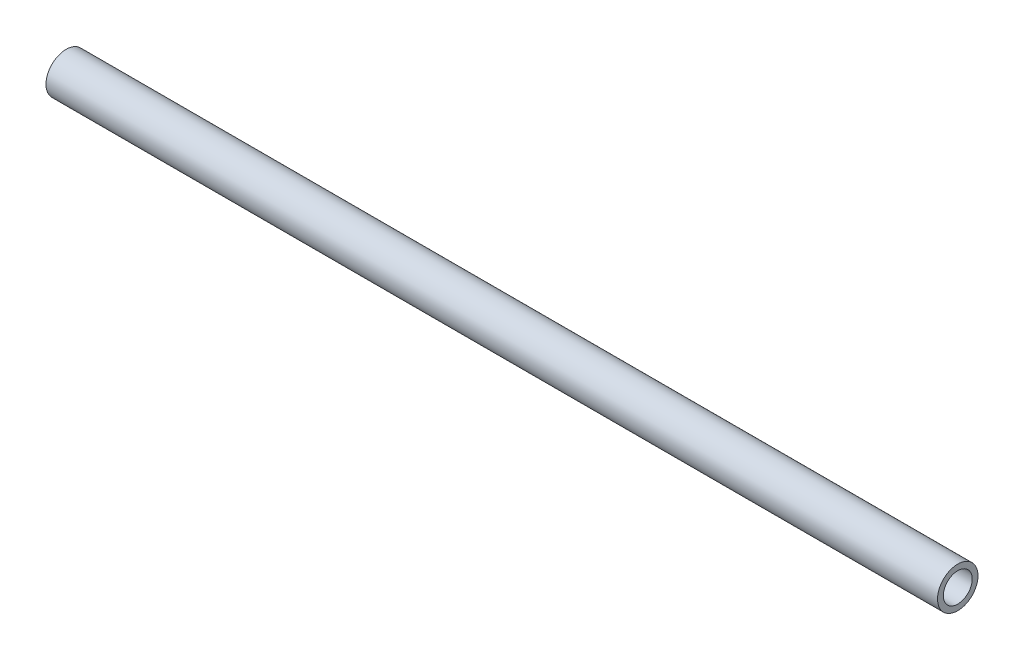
SolidWorks part; units mm, degrees
ref_plane "Front" through (0, 0, 0) normal (0, 0, 1) x (1, 0, 0)
ref_plane "Top" through (0, 0, 0) normal (0, 1, 0) x (1, 0, 0)
ref_plane "Right" through (0, 0, 0) normal (1, 0, 0) x (0, 0, -1)
sketch "Sketch1" plane through (0, 0, 0) normal (0, 0, 1) x (1, 0, 0)
  line L0 (0, 0) -> (469.9, 0)
  line L1 (9.9848, 0) -> (-9.9848, 0) construction
  dimension "D1" = 469.9
other "Structural Member1"
ref_plane "Plane1" through (0, 0, 0) normal (1, 0, 0) x (0, 0, -1)
sketch "Sketch11" plane through (0, 0, 0) normal (1, 0, 0) x (0, 0, -1)
  circle A0 centre (0, 0) radius 7.62
  circle A1 centre (0, 0) radius 10.668
  point P3 (0, 0)
  dimension "D1" = 21.336
  dimension "D2" = 15.24
